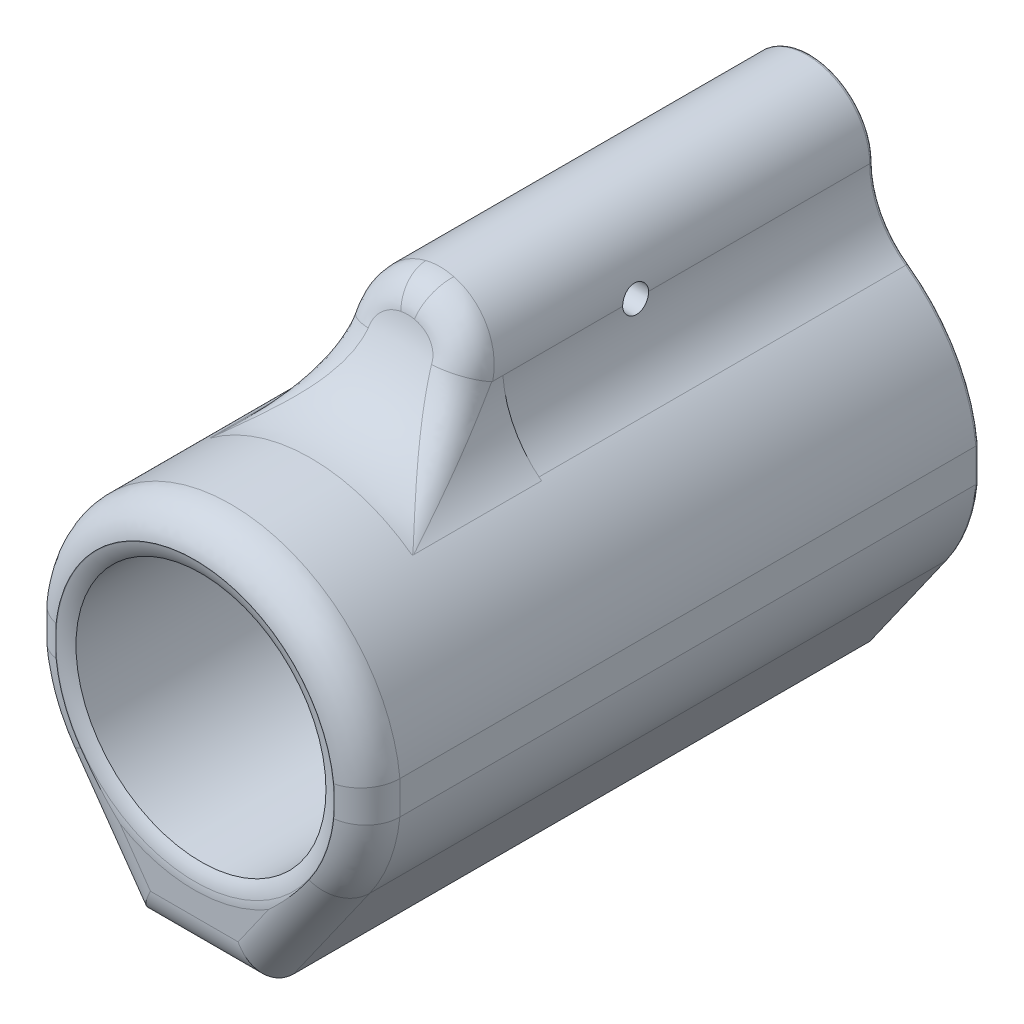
SolidWorks part; units mm, degrees
ref_plane "Front Plane" through (0, 0, 0) normal (0, 0, 1) x (1, 0, 0)
ref_plane "Top Plane" through (0, 0, 0) normal (0, 1, 0) x (1, 0, 0)
ref_plane "Right Plane" through (0, 0, 0) normal (1, 0, 0) x (0, 0, -1)
imported_body "Imported3"
sketch "Sketch1" plane through (0, 0, 28.2391) normal (0, 0, -1) x (-1, 0, 0)
  line L0 (10.5897, -7.4616) -> (4.792, -15.6899)
  line L1 (4.792, -15.6899) -> (-4.792, -15.6899)
  line L2 (-4.792, -15.6899) -> (-10.5897, -7.4616)
  line L3 (-12.892, -1.27) -> (-12.892, 1.27)
  line L4 (12.892, 1.27) -> (12.892, -1.27)
  line L5 (4.792, -15.6899) -> (-4.792, -15.6899) construction
  line L6 (0, 20.667) -> (0, -15.6899) construction
  arc A0 (12.892, -1.27) -> (10.5897, -7.4616) centre (0, 0) cw
  arc A1 (-10.5897, -7.4616) -> (-12.892, -1.27) centre (0, 0) cw
  arc A2 (-12.892, 1.27) -> (-7.5371, 10.5361) centre (0, 0) cw
  arc A3 (-7.5371, 10.5361) -> (-4.792, 15.875) centre (-11.3563, 15.875) ccw
  arc A4 (-4.792, 15.875) -> (4.792, 15.875) centre (0, 15.875) cw
  arc A5 (4.792, 15.875) -> (7.7413, 10.387) centre (12.1381, 16.2864) ccw
  arc A6 (7.7413, 10.387) -> (12.892, 1.27) centre (0, 0) cw
  arc A7 (4.792, 15.875) -> (0, 20.667) centre (0, 15.875) ccw construction
extrude "Boss-Extrude1" add sketch "Sketch1" along normal up to vertex
sketch "Sketch2" plane through (0, 0, 0) normal (0, 1, 0) x (1, 0, 0)
  line L0 (10.0457, 0) -> (0, 0)
  line L1 (0, 0) -> (0, -46.9406)
  line L2 (0, -46.9406) -> (10.6211, -46.9406)
  line L3 (9.5377, -46.4821) -> (9.5377, -0.508)
  line L4 (9.5377, -0.508) -> (10.0457, 0)
  line L5 (0, 0) -> (0, -46.9406) construction
  arc A0 (10.6211, -46.9406) -> (9.5377, -46.4821) centre (11.1439, -44.1959) cw
  dimension "D5" = 2.794
  dimension "D1" = 9.5377
  dimension "D2" = 45
  dimension "D3" = 10.0457
  dimension "D7" = 0.4585
revolve "Cut-Revolve1" cut sketch "Sketch2" angle 360 about L5
hole_wizard "Hole1" positions "Sketch4" profile "Sketch3" legacy
sketch "Sketch4" plane through (0, 0, 0) normal (0, 0, -1) x (-1, 0, 0)
  point P0 (0, 15.875)
sketch "Sketch3" plane through (0, 15.875, 0) normal (1, 0, 0) x (0, 1, 0)
  line L0 (0, 0) -> (0, 22.987)
  line L1 (0, 22.987) -> (2.2924, 22.987)
  line L2 (2.2924, 22.987) -> (2.2924, 0.254)
  line L3 (2.2924, 0.254) -> (2.5464, 0)
  line L4 (2.5464, 0) -> (0, 0)
  line L5 (0, -6.4453) -> (0, 115.525) construction
  line L6 (-2.2924, 0.254) -> (-2.5464, 0) construction
  dimension "Diameter" = 4.5847
  dimension "Depth" = 22.987
  dimension "C-Sink Angle" = 90
  dimension "C-Sink Diameter" = 5.0927
ref_plane "Plane1" through (2.0673, 0, 0) normal (-1, 0, 0) x (0, 0, 1)
hole_wizard "Hole2" positions "Sketch6" profile "Sketch5" legacy
sketch "Sketch6" plane through (2.0673, 0, 0) normal (-1, 0, 0) x (0, 0, 1)
  point P0 (18.1102, 15.875)
  dimension "D1" = 18.1102
  dimension "D2" = 15.875
sketch "Sketch5" plane through (2.0673, 15.875, 18.1102) normal (0, 1, 0) x (0, 0, 1)
  line L0 (0, 0) -> (0, 10.922)
  line L1 (0, 10.922) -> (0.9906, 10.922)
  line L2 (0.9906, 10.922) -> (0.9906, 0)
  line L3 (0.9906, 0) -> (0, 0)
  line L4 (0, 110) -> (0, -10) construction
  dimension "Diameter" = 1.9812
  dimension "Depth" = 10.922
ref_plane "Plane2" through (-2.0673, 0, 0) normal (1, 0, 0) x (0, 0, -1)
mirror "Mirror1" about plane through (0, 0, 0) normal (1, 0, 0) of "Hole2"
hole_wizard "Hole4" positions "Sketch10" profile "Sketch9" legacy
sketch "Sketch10" plane through (0, -15.6899, 0) normal (0, -1, 0) x (1, 0, 0)
  point P0 (0, 7.493)
sketch "Sketch9" plane through (0, -15.6899, 7.493) normal (1, 0, 0) x (0, 0, -1)
  line L0 (0, 0) -> (0, 6.1522)
  line L1 (0, 6.1522) -> (3.175, 6.1522)
  line L2 (3.175, 6.1522) -> (3.175, 0)
  line L3 (3.175, 0) -> (0, 0)
  line L4 (0, 110) -> (0, -10) construction
  dimension "Diameter" = 6.35
  dimension "Depth" = 6.1522
hole_wizard "Hole5" positions "Sketch12" profile "Sketch11" legacy
sketch "Sketch12" plane through (0, -15.6899, 0) normal (0, -1, 0) x (1, 0, 0)
  point P0 (0, 26.543)
sketch "Sketch11" plane through (0, -15.6899, 26.543) normal (1, 0, 0) x (0, 0, -1)
  line L0 (0, 0) -> (0, 6.1522)
  line L1 (0, 6.1522) -> (3.175, 6.1522)
  line L2 (3.175, 6.1522) -> (3.175, 0)
  line L3 (3.175, 0) -> (0, 0)
  line L4 (0, 110) -> (0, -10) construction
  dimension "Diameter" = 6.35
  dimension "Depth" = 6.1522
ref_plane "Plane3" through (0, 14.5098, 0) normal (0, 1, 0) x (-1, 0, 0)
hole_wizard "Hole6" positions "Sketch14" profile "Sketch13" legacy
sketch "Sketch14" plane through (0, 14.5098, 0) normal (0, 1, 0) x (-1, 0, 0)
  point P0 (0, 7.493)
sketch "Sketch13" plane through (0, 14.5098, 7.493) normal (1, 0, 0) x (0, 0, 1)
  line L0 (0, 0) -> (0, 30.1997)
  line L1 (0, 30.1997) -> (1.8415, 30.1997)
  line L2 (1.8415, 30.1997) -> (1.8415, 0)
  line L3 (1.8415, 0) -> (0, 0)
  line L4 (0, 110) -> (0, -10) construction
  dimension "Diameter" = 3.683
  dimension "Depth" = 30.1997
fillet "Fillet1" radius 0.254 1 edges at (-2.5464, 15.875, 0)
fillet "Fillet2" radius 0.254 12 edges at (0, -15.6899, 0) (7.6909, -11.5757, 0) (12.1422, -4.515, 0) (12.892, 0, 0) (11.2162, 6.4819, 0) (5.5185, 12.8734, 0) (0, 20.667, 0) (-5.6571, 12.8034, 0) (-11.2789, 6.3721, 0) (-12.892, 0, 0) (-7.6909, -11.5757, 0) (-12.1422, -4.515, 0)
fillet "Fillet3" radius 0.254 1 edges at (10.0457, 0, 0)
fillet "Fillet4" radius 2.794 1 edges at (0, -15.6899, 46.99)
